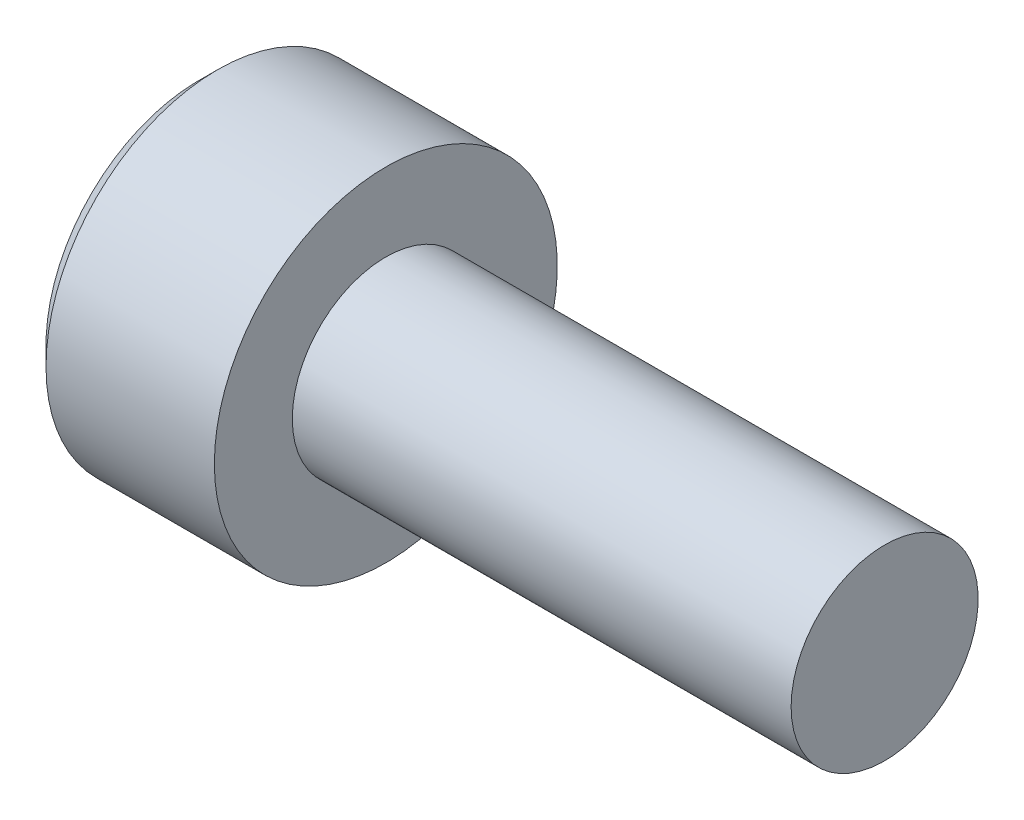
SolidWorks part; units mm, degrees
ref_plane "Front Plane" through (0, 0, 0) normal (0, 0, 1) x (1, 0, 0)
ref_plane "Top Plane" through (0, 0, 0) normal (0, 1, 0) x (1, 0, 0)
ref_plane "Right Plane" through (0, 0, 0) normal (1, 0, 0) x (0, 0, -1)
sketch "Sketch1" plane through (0, 0, 0) normal (0, 0, 1) x (1, 0, 0)
  line L2 (-3, 0) -> (8, 0)
  line L3 (8, 0) -> (8, 1.5)
  line L4 (8, 1.5) -> (0, 1.5)
  line L5 (0, 1.5) -> (0, 2.75)
  line L6 (0, 2.75) -> (-3, 2.75)
  line L7 (-3, 2.75) -> (-3, 0)
  line L8 (-3, 0) -> (8, 0) construction
  line L9 (0, 0) -> (0, 2.75) construction
  dimension "E" = 3
  dimension "L" = 8
  dimension "A" = 5.5
  dimension "M" = 3
revolve "Revolve1" add sketch "Sketch1" about L8
chamfer "Chamfer1" distance 0.3 1 edges at (-3, 0, 2.75)
sketch "Sketch2" plane through (0, 0, 0) normal (0, 0, 1) x (1, 0, 0)
  line L0 (-0.9489, 0) -> (-1.7, 1.25)
  line L1 (-3, 0) -> (8, 0) construction
  line L2 (-1.7, 1.25) -> (-3, 1.25)
  line L3 (-3, 2.75) -> (-3, 0) construction
  line L4 (-3, 1.25) -> (-3, 0)
  line L5 (-3, 0) -> (-0.9489, 0) construction
  line L6 (-0.9489, 0) -> (-3, 0)
  dimension "FIX_3" = 59
revolve "Cut-Revolve1" cut sketch "Sketch2" about L5
sketch "Sketch3" plane through (-3, 0, 0) normal (-1, 0, 0) x (0, 0, 1)
  line L0 (0, -1.4434) -> (0, 1.4434) construction
  line L1 (0, -1.4434) -> (1.25, -0.7217)
  line L2 (1.25, -0.7217) -> (1.25, 0.7217)
  line L3 (1.25, 0.7217) -> (0, 1.4434)
  line L4 (0, 1.4434) -> (-1.25, 0.7217)
  line L5 (-1.25, 0.7217) -> (-1.25, -0.7217)
  line L6 (-1.25, -0.7217) -> (0, -1.4434)
  line L7 (-1.25, 0) -> (1.25, 0) construction
  circle A0 centre (0, 0) radius 1.25 construction
extrude "Cut-Extrude1" cut sketch "Sketch3" against normal blind 1.3
